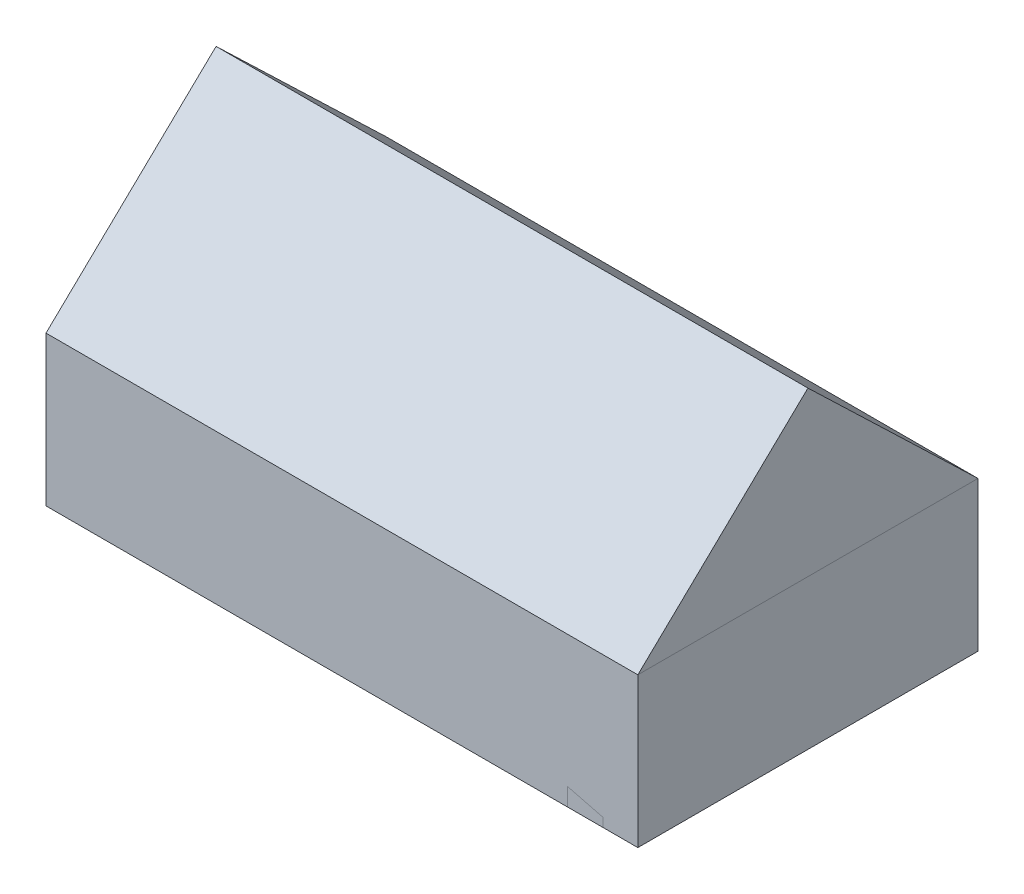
SolidWorks part; units mm, degrees
ref_plane "Plan de face" through (0, 0, 0) normal (0, 0, 1) x (1, 0, 0)
ref_plane "Plan de dessus" through (0, 0, 0) normal (0, 1, 0) x (1, 0, 0)
ref_plane "Plan de droite" through (0, 0, 0) normal (1, 0, 0) x (0, 0, -1)
imported_body "51DUP2-2-surface1"
imported_body "51DUP1-1-surface1"
sketch "Esquisse1" plane through (0, 0, 18.5) normal (0, 0, -1) x (-1, 0, 0)
  line L0 (43.5157, -12.9564) -> (-43.4843, -12.9564) construction
  line L1 (-32.9843, -12.9564) -> (-27.7343, -12.9564)
  line L2 (-32.9843, -12.9564) -> (-32.9843, -0.5064)
  line L3 (-32.9843, -0.5064) -> (-27.7343, -0.5064)
  line L4 (-27.7343, -12.9564) -> (-27.7343, -0.5064)
  line L5 (43.5157, 9.0436) -> (43.5157, -12.9564) construction
  line L6 (-17.9843, -12.9564) -> (-13.3343, -12.9564)
  line L7 (-17.9843, -12.9564) -> (-17.9843, -0.9564)
  line L8 (-17.9843, -0.9564) -> (-13.3343, -0.9564)
  line L9 (-13.3343, -12.9564) -> (-13.3343, -0.9564)
  line L10 (15.4657, -6.9564) -> (21.4657, -6.9564)
  line L11 (15.4657, -6.9564) -> (15.4657, -0.3564)
  line L12 (15.4657, -0.3564) -> (21.4657, -0.3564)
  line L13 (21.4657, -6.9564) -> (21.4657, -0.3564)
  line L14 (31.5157, -6.9564) -> (37.5157, -6.9564)
  line L15 (31.5157, -6.9564) -> (31.5157, -0.3564)
  line L16 (31.5157, -0.3564) -> (37.5157, -0.3564)
  line L17 (37.5157, -6.9564) -> (37.5157, -0.3564)
  dimension "D1" = 10.5
  dimension "D2" = 5.25
  dimension "D3" = 9.75
  dimension "D4" = 4.65
  dimension "D5" = 6
  dimension "D6" = 6
  dimension "D7" = 10.05
  dimension "D8" = 6
  dimension "D9" = 6
  dimension "D10" = 6.6
  dimension "D11" = 6.6
  dimension "D12" = 12
  dimension "D13" = 12.45
extrude "Extrusion3" add sketch "Esquisse1" against normal blind 1.5
sketch "Esquisse3" plane through (0, 0, 68.5) normal (0, 0, 1) x (1, 0, 0)
  line L0 (-43.5157, -12.9564) -> (43.4843, -12.9564) construction
  line L1 (-38.1157, -0.5064) -> (-32.1157, -0.5064)
  line L2 (-38.1157, -0.5064) -> (-38.1157, -7.2564)
  line L3 (-38.1157, -7.2564) -> (-32.1157, -7.2564)
  line L4 (-32.1157, -0.5064) -> (-32.1157, -7.2564)
  line L5 (-20.1141, -0.3564) -> (-14.5641, -0.3564)
  line L6 (-20.1141, -0.3564) -> (-20.1141, -3.6564)
  line L7 (-20.1141, -3.6564) -> (-14.5641, -3.6564)
  line L8 (-14.5641, -0.3564) -> (-14.5641, -3.6564)
  line L9 (16.3343, -0.5064) -> (22.3343, -0.5064)
  line L10 (16.3343, -0.5064) -> (16.3343, -7.2564)
  line L11 (16.3343, -7.2564) -> (22.3343, -7.2564)
  line L12 (22.3343, -0.5064) -> (22.3343, -7.2564)
  line L13 (33.1343, -12.9564) -> (38.3843, -12.9564)
  line L14 (33.1343, -12.9564) -> (33.1343, -0.5064)
  line L15 (33.1343, -0.5064) -> (38.3843, -0.5064)
  line L16 (38.3843, -12.9564) -> (38.3843, -0.5064)
  line L17 (-43.5157, 9.0436) -> (-43.5157, -12.9564) construction
  dimension "D1" = 5.4
  dimension "D2" = 6
  dimension "D3" = 5.55
  dimension "D4" = 3.3
  dimension "D5" = 6.75
  dimension "D6" = 6.75
  dimension "D7" = 6
  dimension "D8" = 5.1
  dimension "D9" = 5.25
  dimension "D10" = 10.8
  dimension "D11" = 5.7
  dimension "D12" = 12.45
  dimension "D13" = 9.3
  dimension "D14" = 6
  dimension "D16" = 5.7
extrude "Extrusion4" add sketch "Esquisse3" against normal blind 1.5
sketch "Esquisse4" plane through (-43.5157, 0, 0) normal (-1, 0, 0) x (0, 0, 1)
  line L0 (18.5, 9.0436) -> (18.5, -12.9564) construction
  line L1 (42, -0.2064) -> (45, -0.2064)
  line L2 (42, -0.2064) -> (42, -3.5064)
  line L3 (42, -3.5064) -> (45, -3.5064)
  line L4 (45, -0.2064) -> (45, -3.5064)
  line L5 (43.5, 33.0436) -> (43.5, -15.5574) construction
  line L6 (68.5, -12.9564) -> (18.5, -12.9564) construction
  dimension "D1" = 3
  dimension "D2" = 3.3
  dimension "D3" = 23.5
  dimension "D4" = 9.45
extrude "Extrusion6" add sketch "Esquisse4" against normal blind 1.5
